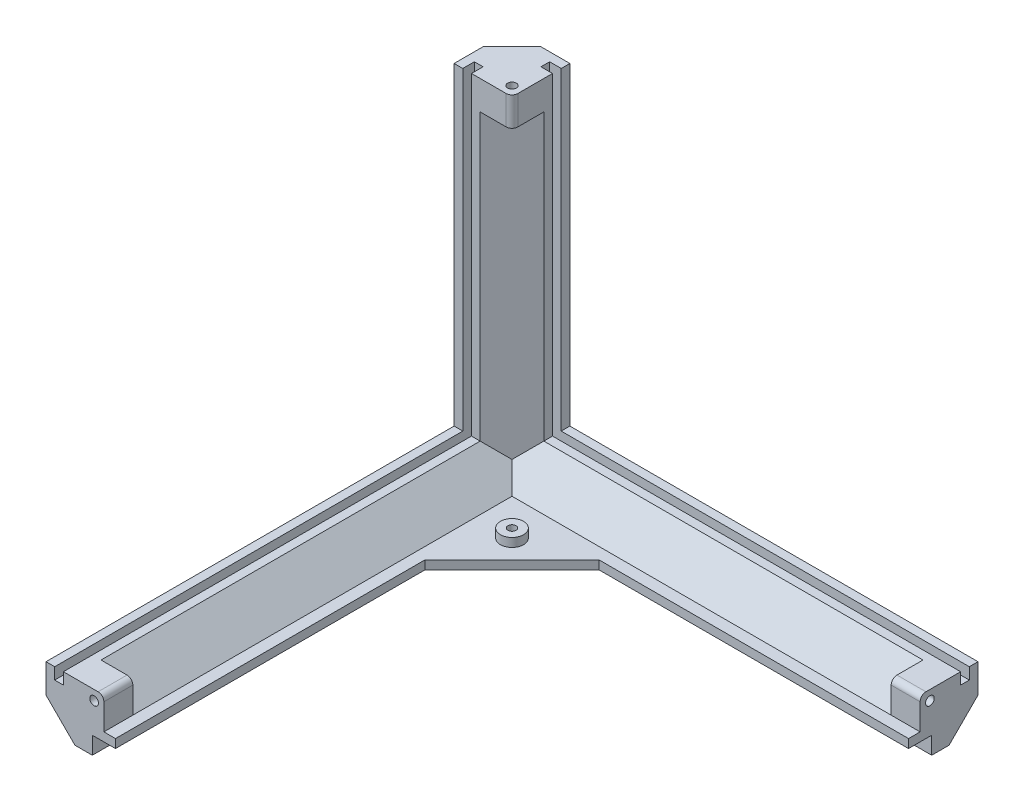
SolidWorks part; units mm, degrees
ref_plane "Front Plane" through (0, 0, 0) normal (0, 0, 1) x (1, 0, 0)
ref_plane "Top Plane" through (0, 0, 0) normal (0, 1, 0) x (1, 0, 0)
ref_plane "Right Plane" through (0, 0, 0) normal (1, 0, 0) x (0, 0, -1)
sketch "Sketch1" plane through (0, 0, 0) normal (0, 1, 0) x (1, 0, 0)
  line L0 (-60.0579, 3.4523) -> (-50.0579, 3.4523) construction
  line L1 (-50.0579, 3.4523) -> (-50.0579, 13.4523) construction
  line L2 (-60.0579, 3.4523) -> (-50.0579, 13.4523)
  line L3 (-50.0579, 13.4523) -> (-40.0579, 13.4523)
  line L4 (-40.0579, 13.4523) -> (-40.0579, 10.4523)
  line L5 (-40.0579, 10.4523) -> (-44.0579, 10.4523)
  line L6 (-44.0579, 10.4523) -> (-44.0579, 7.4523)
  line L7 (-44.0579, 7.4523) -> (-40.0579, 7.4523)
  line L8 (-40.0579, 7.4523) -> (-40.0579, 4.4523)
  line L9 (-60.0579, 3.4523) -> (-60.0579, -6.5477)
  line L10 (-60.0579, -6.5477) -> (-57.0579, -6.5477)
  line L11 (-57.0579, -6.5477) -> (-57.0579, -2.5477)
  line L12 (-57.0579, -2.5477) -> (-54.0579, -2.5477)
  line L13 (-54.0579, -2.5477) -> (-54.0579, -6.5477)
  line L14 (-54.0579, -6.5477) -> (-51.0579, -6.5477)
  line L15 (-40.0579, 4.4523) -> (-51.0579, -6.5477)
extrude "Boss-Extrude1" add sketch "Sketch1" along normal blind 108.5
sketch "Sketch2" plane through (0, 0, 6.5477) normal (0, 0, 1) x (1, 0, 0)
  line L0 (-54.0579, 0) -> (-54.0579, -3.2274) construction
  line L1 (-57.0579, 0) -> (-57.0579, -4)
  line L2 (-57.0579, -4) -> (-54.0579, -4)
  line L3 (-54.0579, -4) -> (-54.0579, 0)
  line L4 (-54.0579, 0) -> (-51.0579, 0)
  line L5 (-57.0579, 0) -> (-60.0579, 0)
  line L6 (-60.0579, 0) -> (-60.0579, -10)
  line L7 (-60.0579, -10) -> (-50.0579, -10) construction
  line L8 (-50.0579, -10) -> (-50.0579, -20) construction
  line L9 (-50.0579, -20) -> (-60.0579, -10)
  line L10 (-50.0579, -20) -> (-40.0579, -20)
  line L11 (-40.0579, -20) -> (-40.0579, -17)
  line L12 (-40.0579, -17) -> (-44.0579, -17)
  line L13 (-44.0579, -17) -> (-44.0579, -14)
  line L14 (-44.0579, -14) -> (-40.0579, -14)
  line L15 (-40.0579, -14) -> (-40.0579, -11)
  line L16 (-40.0579, -11) -> (-51.0579, 0)
extrude "Boss-Extrude2" add sketch "Sketch2" along normal blind 141 separate body
sketch "Sketch3" plane through (-40.0579, 0, 0) normal (1, 0, 0) x (0, 0, -1)
  line L0 (-6.5477, -11) -> (-6.5477, -14)
  line L1 (-6.5477, -14) -> (-2.5477, -14)
  line L2 (-2.5477, -14) -> (-2.5477, -17)
  line L3 (-2.5477, -17) -> (-6.5477, -17)
  line L4 (-6.5477, -17) -> (-6.5477, -20)
  line L5 (-6.5477, -20) -> (3.4523, -20)
  line L6 (7.4523, 0) -> (7.4523, -4)
  line L7 (7.4523, -4) -> (10.4523, -4)
  line L8 (10.4523, -4) -> (10.4523, 0)
  line L9 (10.4523, 0) -> (13.4523, 0)
  line L10 (13.4523, 0) -> (13.4523, -10)
  line L11 (13.4523, -10) -> (3.4523, -20)
  line L12 (-6.5477, -11) -> (4.4523, 0)
  line L13 (4.4523, 0) -> (7.4523, 0)
extrude "Boss-Extrude3" add sketch "Sketch3" along normal blind 141 separate body
sketch "Sketch4" plane through (0, 0, -13.4523) normal (0, 0, -1) x (-1, 0, 0)
  line L0 (40.0579, 0) -> (40.0579, -20)
  line L1 (40.0579, -20) -> (60.0579, -20)
  line L2 (60.0579, -20) -> (60.0579, 0)
  line L3 (60.0579, 0) -> (40.0579, 0)
extrude "Boss-Extrude4" add sketch "Sketch4" against normal blind 20
sketch "Sketch5" plane through (0, 0, 6.5477) normal (0, 0, 1) x (1, 0, 0)
  line L0 (-50.0579, -20) -> (-60.0579, -10)
  line L1 (-60.0579, -10) -> (-60.0579, -20)
  line L2 (-60.0579, -20) -> (-50.0579, -20)
extrude "Cut-Extrude1" cut sketch "Sketch5" against normal blind 20
sketch "Sketch6" plane through (0, 0, 0) normal (0, 1, 0) x (1, 0, 0)
  line L0 (-60.0579, 3.4523) -> (-50.0579, 13.4523)
  line L1 (-50.0579, 13.4523) -> (-60.0579, 13.4523)
  line L2 (-60.0579, 13.4523) -> (-60.0579, 3.4523)
extrude "Cut-Extrude2" cut sketch "Sketch6" against normal blind 20
sketch "Sketch7" plane through (-40.0579, 0, 0) normal (1, 0, 0) x (0, 0, -1)
  line L0 (13.4523, -10) -> (3.4523, -20)
  line L1 (3.4523, -20) -> (13.4523, -20)
  line L2 (13.4523, -20) -> (13.4523, -10)
extrude "Cut-Extrude3" cut sketch "Sketch7" against normal blind 20
sketch "Sketch8" plane through (-40.0579, 0, 0) normal (1, 0, 0) x (0, 0, -1)
  line L0 (-6.5477, -14) -> (-2.5477, -14)
  line L1 (-2.5477, -14) -> (-2.5477, -17)
  line L2 (-2.5477, -17) -> (-6.5477, -17)
  line L3 (-6.5477, -17) -> (-6.5477, -14)
extrude "Cut-Extrude4" cut sketch "Sketch8" against normal blind 4
sketch "Sketch9" plane through (-40.0579, 0, 0) normal (1, 0, 0) x (0, 0, -1)
  line L0 (7.4523, 0) -> (10.4523, 0)
  line L1 (10.4523, 0) -> (10.4523, -4)
  line L2 (10.4523, -4) -> (7.4523, -4)
  line L3 (7.4523, -4) -> (7.4523, 0)
extrude "Cut-Extrude5" cut sketch "Sketch9" against normal blind 4
sketch "Sketch10" plane through (0, 0, 0) normal (0, 1, 0) x (1, 0, 0)
  line L0 (-57.0579, -2.5477) -> (-54.0579, -2.5477)
  line L1 (-54.0579, -2.5477) -> (-54.0579, -6.5477)
  line L2 (-54.0579, -6.5477) -> (-57.0579, -6.5477)
  line L3 (-57.0579, -6.5477) -> (-57.0579, -2.5477)
extrude "Cut-Extrude6" cut sketch "Sketch10" against normal blind 4
sketch "Sketch11" plane through (0, 0, 0) normal (0, 1, 0) x (1, 0, 0)
  line L0 (-51.0579, -6.5477) -> (-40.0579, 4.4523)
  line L1 (-40.0579, 4.4523) -> (-40.0579, -6.5477)
  line L2 (-40.0579, -6.5477) -> (-51.0579, -6.5477)
extrude "Cut-Extrude7" cut sketch "Sketch11" against normal blind 11
sketch "Sketch12" plane through (-40.0579, 0, 0) normal (-1, 0, 0) x (0, 0, 1)
  line L0 (6.5477, -11) -> (-4.4523, -11)
  line L1 (-4.4523, -11) -> (-4.4523, 0)
  line L2 (-4.4523, 0) -> (6.5477, -11)
extrude "Boss-Extrude5" add sketch "Sketch12" along normal blind 10
sketch "Sketch13" plane through (0, 0, 6.5477) normal (0, 0, -1) x (-1, 0, 0)
  line L0 (40.0579, -11) -> (51.0579, -11)
  line L1 (51.0579, -11) -> (51.0579, 0)
  line L2 (51.0579, 0) -> (40.0579, -11)
extrude "Boss-Extrude6" add sketch "Sketch13" along normal blind 10
sketch "Sketch14" plane through (0, -17, 0) normal (0, 1, 0) x (1, 0, 0)
  line L0 (-44.0579, -2.5477) -> (-44.0579, -147.5477)
  line L1 (-44.0579, -147.5477) -> (-40.0579, -147.5477)
  line L2 (-40.0579, -147.5477) -> (-40.0579, -6.5477)
  line L3 (-40.0579, -6.5477) -> (100.9421, -6.5477)
  line L4 (100.9421, -6.5477) -> (100.9421, -2.5477)
  line L5 (100.9421, -2.5477) -> (-44.0579, -2.5477)
extrude "Cut-Extrude8" cut sketch "Sketch14" against normal through all
sketch "Sketch15" plane through (0, 0, 6.5477) normal (0, 0, 1) x (1, 0, 0)
  line L0 (100.9421, -14) -> (100.9421, -11)
  line L1 (100.9421, -11) -> (-40.0579, -11)
  line L2 (-40.0579, -11) -> (-40.0579, -14)
  line L3 (-40.0579, -14) -> (100.9421, -14)
extrude "Boss-Extrude7" add sketch "Sketch15" along normal blind 4
sketch "Sketch16" plane through (-40.0579, 0, 0) normal (1, 0, 0) x (0, 0, -1)
  line L0 (-10.5477, -14) -> (-10.5477, -11)
  line L1 (-10.5477, -11) -> (-147.5477, -11)
  line L2 (-147.5477, -11) -> (-147.5477, -14)
  line L3 (-147.5477, -14) -> (-10.5477, -14)
extrude "Boss-Extrude8" add sketch "Sketch16" along normal blind 4
chamfer "Chamfer1" distance 30 angle 45 1 edges at (-36.0579, -12.5, 10.5477)
chamfer "Chamfer2" distance 20 angle 45 1 edges at (-44.0579, -17, 2.5477)
sketch "Sketch17" plane through (0, -14, 0) normal (0, -1, 0) x (1, 0, 0)
  line L0 (-34.0579, 12.5477) -> (-21.0579, 25.5477) construction
  line L1 (-44.0579, 22.5477) -> (-24.0579, 2.5477) construction
  line L2 (-6.0579, 10.5477) -> (-36.0579, 40.5477) construction
  circle A1 centre (-27.5579, 19.0477) radius 1.4
extrude "Cut-Extrude9" cut sketch "Sketch17" against normal blind 10
sketch "Sketch18" plane through (100.9421, 0, 0) normal (1, 0, 0) x (0, 0, -1)
  line L0 (-6.5477, -11) -> (-6.5477, 9.0071) construction
  line L1 (4.4523, 0) -> (-6.5477, 0) construction
  line L2 (4.4523, 0) -> (-6.5477, 0)
  line L3 (-6.5477, 0) -> (-6.5477, -11)
  line L4 (-6.5477, -11) -> (4.4523, 0)
  line L5 (-1.0477, -5.5) -> (-3.1691, -3.3787) construction
  circle A0 centre (-3.1691, -3.3787) radius 1.5
extrude "Boss-Extrude9" add sketch "Sketch18" against normal blind 10
sketch "Sketch19" plane through (0, 0, 147.5477) normal (0, 0, 1) x (1, 0, 0)
  line L0 (-51.0579, 0) -> (-37.2935, 0) construction
  line L1 (-40.0579, -11) -> (-40.0579, 0) construction
  line L2 (-51.0579, 0) -> (-40.0579, -11)
  line L3 (-40.0579, -11) -> (-40.0579, 0)
  line L4 (-40.0579, 0) -> (-51.0579, 0)
  line L5 (-45.5579, -5.5) -> (-43.4365, -3.3787) construction
  circle A0 centre (-43.4365, -3.3787) radius 1.5
extrude "Boss-Extrude10" add sketch "Sketch19" against normal blind 10
sketch "Sketch20" plane through (0, 108.5, 0) normal (0, 1, 0) x (1, 0, 0)
  line L0 (-51.0579, -6.5477) -> (-34.7989, -6.5477) construction
  line L1 (-40.0579, 4.4523) -> (-40.0579, -6.5477) construction
  line L2 (-51.0579, -6.5477) -> (-40.0579, -6.5477)
  line L3 (-40.0579, -6.5477) -> (-40.0579, 4.4523)
  line L4 (-40.0579, 4.4523) -> (-51.0579, -6.5477)
  line L5 (-45.5579, -1.0477) -> (-43.4365, -3.1691) construction
  circle A0 centre (-43.4365, -3.1691) radius 1.5
extrude "Boss-Extrude11" add sketch "Sketch20" against normal blind 10
fillet "Fillet1" radius 2 3 edges at (95.9421, 0, 6.5477) (-40.0579, 0, 142.5477) (-40.0579, 103.5, 6.5477)
sketch "Esquisse2" plane through (0, -11, 0) normal (0, 1, 0) x (1, 0, 0)
  circle A0 centre (-27.5579, -19.0477) radius 1.4
  circle A1 centre (-27.5579, -19.0477) radius 4
extrude "Boss.-Extru.1" add sketch "Esquisse2" along normal blind 3
